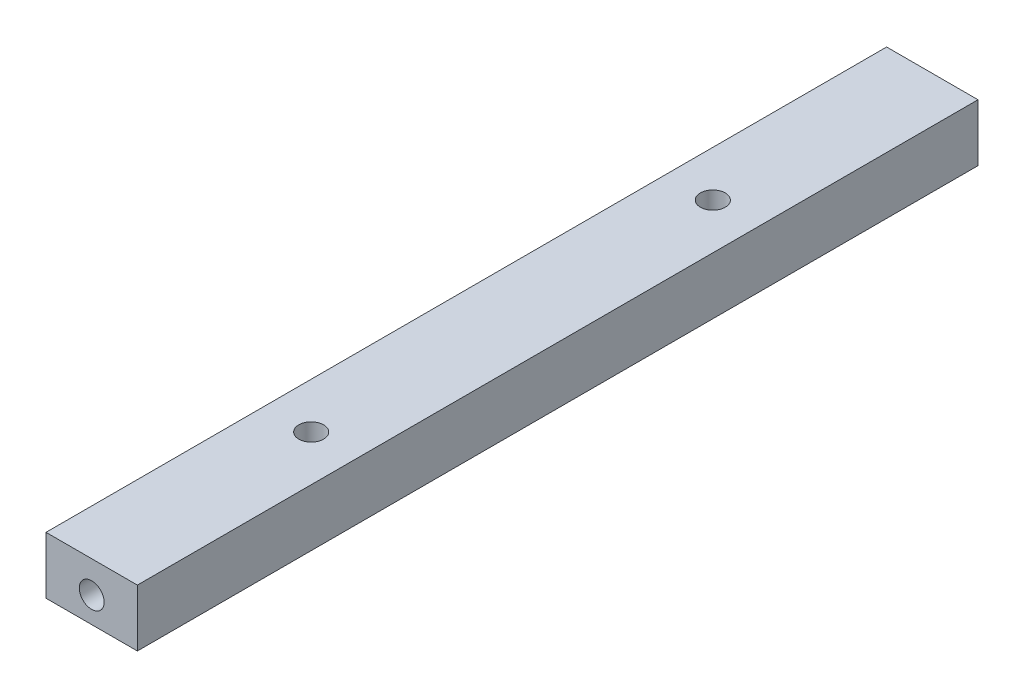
SolidWorks part; units mm, degrees
ref_plane "Plane1" through (0, 0, 0) normal (0, 0, 1) x (1, 0, 0)
ref_plane "Plane2" through (0, 0, 0) normal (0, 1, 0) x (1, 0, 0)
ref_plane "Plane3" through (0, 0, 0) normal (1, 0, 0) x (0, 0, -1)
sketch "Sketch1" plane through (0, 0, 0) normal (0, 0, 1) x (1, 0, 0)
  line L1 (0, 0) -> (12.7, 0)
  line L2 (0, 0) -> (0, 7.9375)
  line L3 (0, 7.9375) -> (12.7, 7.9375)
  line L4 (12.7, 0) -> (12.7, 7.9375)
  dimension "D1" = 7.9375
  dimension "D2" = 12.7
extrude "mount_bar" add sketch "Sketch1" along normal blind 116.84
sketch "Sketch2" plane through (0, 0, 116.84) normal (0, 0, 1) x (1, 0, 0)
  line L0 (6.35, 0) -> (6.35, 7.9375) construction
  line L1 (0, 0) -> (12.7, 0) construction
  line L2 (12.7, 7.9375) -> (0, 7.9375) construction
  circle A0 centre (6.35, 3.556) radius 1.7272
  dimension "D1" = 3.556
  dimension "D2" = 3.4544
extrude "end_hole1" cut sketch "Sketch2" against normal blind 10.16
sketch "Sketch3" plane through (0, 0, 0) normal (0, 0, -1) x (-1, 0, 0)
  circle A0 centre (-6.35, 3.556) radius 1.7272
  dimension "D1" = 3.4544
extrude "end_hole2" cut sketch "Sketch3" against normal blind 10.16
sketch "Sketch4" plane through (0, 7.9375, 0) normal (0, 1, 0) x (-1, 0, 0)
  line L0 (-6.35, 0.0282) -> (-6.35, 30.5082) construction
  line L2 (-6.35, 106.68) -> (-6.35, 116.84) construction
  line L3 (0, 116.84) -> (0, 0) construction
  line L4 (-12.7, 58.42) -> (0, 58.42) construction
  line L5 (-12.7, 116.84) -> (-12.7, 0) construction
  circle A0 centre (-6.35, 30.5082) radius 1.7272
  circle A1 centre (-6.35, 86.3318) radius 1.7272
  dimension "D3" = 3.4544
  dimension "D1" = 6.35
  dimension "D2" = 30.48
extrude "top_holes" cut sketch "Sketch4" against normal blind 10.16
